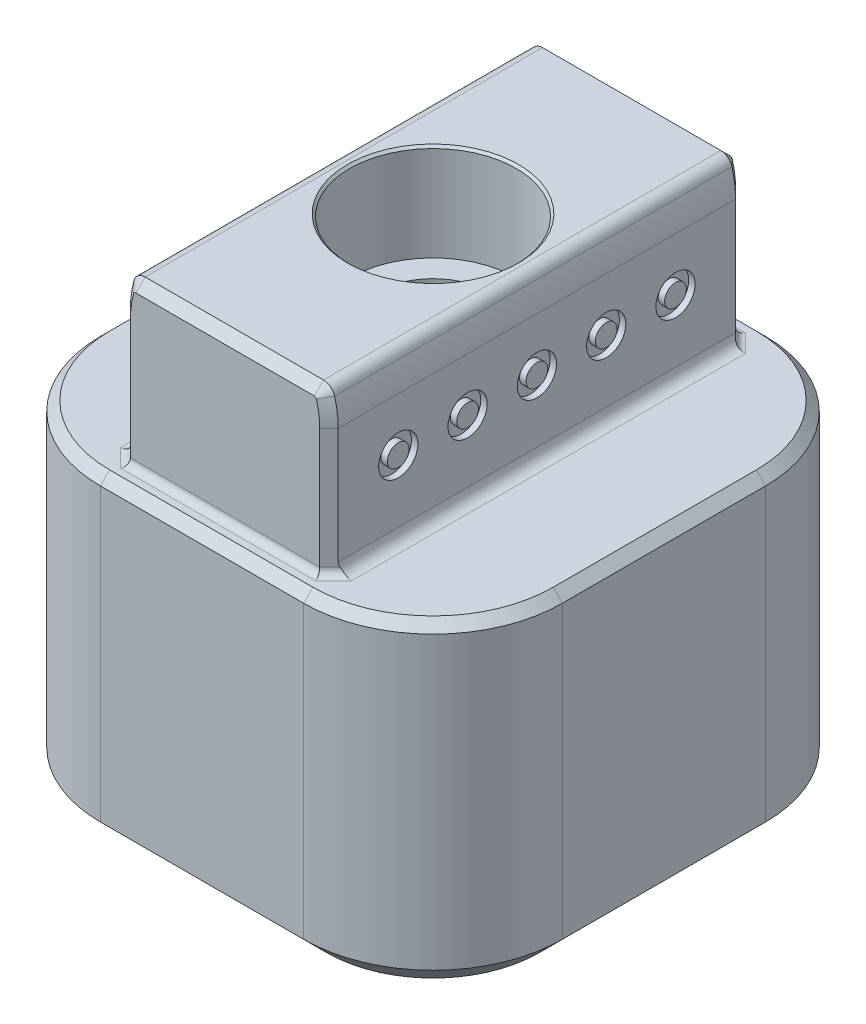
SolidWorks part; units mm, degrees
ref_plane "Front Plane" through (0, 0, 0) normal (0, 0, 1) x (1, 0, 0)
ref_plane "Top Plane" through (0, 0, 0) normal (0, 1, 0) x (1, 0, 0)
ref_plane "Right Plane" through (0, 0, 0) normal (1, 0, 0) x (0, 0, -1)
sketch "Sketch1" plane through (0, 0, 0) normal (0, 1, 0) x (1, 0, 0)
  line L0 (-10, 0) -> (10, 0) construction
  line L1 (-4.4, 10) -> (4.4, 10)
  line L2 (-10, 4.4) -> (-10, -4.4)
  line L3 (-4.4, -10) -> (4.4, -10)
  line L4 (10, 4.4) -> (10, -4.4)
  line L5 (0, 10) -> (0, -10) construction
  arc A4 (4.4, 10) -> (10, 4.4) centre (4.4, 4.4) cw
  arc A5 (10, -4.4) -> (4.4, -10) centre (4.4, -4.4) cw
  arc A6 (-4.4, -10) -> (-10, -4.4) centre (-4.4, -4.4) cw
  arc A7 (-10, 4.4) -> (-4.4, 10) centre (-4.4, 4.4) cw
  dimension "D3" = 5.6
  dimension "D1" = 20
  dimension "D2" = 20
extrude "Boss-Extrude1" add sketch "Sketch1" along normal blind 14 from offset 14
sketch "Sketch2" plane through (0, 0, 0) normal (0, 1, 0) x (1, 0, 0)
  line L0 (0, 9) -> (0, -9) construction
  line L1 (-4.4975, 9) -> (4.4975, 9)
  line L2 (-4.4975, 9) -> (-4.4975, -9)
  line L3 (-4.4975, -9) -> (4.4975, -9)
  line L4 (4.4975, 9) -> (4.4975, -9)
  line L5 (-4.4975, 0) -> (4.4975, 0) construction
  line L6 (4.4, 10) -> (-4.4, 10) construction
  dimension "D1" = 8.995
  dimension "D2" = 1
extrude "Boss-Extrude2" add sketch "Sketch2" along normal blind 7
sketch "Sketch3" plane through (0, 0, 9) normal (0, 0, 1) x (1, 0, 0)
  line L0 (4.4975, 7) -> (4.4975, 0) construction
  line L1 (-4.4975, 7) -> (4.4975, 7) construction
  line L2 (3.8598, 7) -> (4.4975, 7)
  line L3 (4.4975, 7) -> (4.4975, 5.5)
  line L4 (0, 0) -> (0, 7) construction
  line L5 (-4.4975, 7) -> (-4.4975, 5.5)
  line L6 (-3.8598, 7) -> (-4.4975, 7)
  arc A0 (4.4975, 5.5) -> (4.3412, 6.6351) centre (0.2975, 5.5) ccw
  arc A1 (4.3412, 6.6351) -> (3.8598, 7) centre (3.8598, 6.5) ccw
  arc A2 (-4.3412, 6.6351) -> (-3.8598, 7) centre (-3.8598, 6.5) cw
  arc A3 (-4.4975, 5.5) -> (-4.3412, 6.6351) centre (-0.2975, 5.5) cw
  dimension "D2" = 4.2
  dimension "D3" = 0.5
  dimension "D1" = 1.5
extrude "Cut-Extrude3" cut sketch "Sketch3" against normal through all
hole_wizard "CBORE for M4 SHCS1" positions "Sketch4" profile "Sketch5" counterbore size "M4" standard "ANSI Metric"
sketch "Sketch4" plane through (0, 7, 0) normal (0, 1, 0) x (1, 0, 0)
  point P0 (0, 0)
sketch "Sketch5" plane through (0, 7, 0) normal (1, 0, 0) x (0, 0, 1)
  line L0 (0, 0) -> (0, 21)
  line L1 (0, 21) -> (2.5, 21)
  line L3 (2.5, 21) -> (2.5, 4.2)
  line L4 (2.5, 4.2) -> (3.6, 4.2)
  line L5 (3.6, 4.2) -> (3.6, 0)
  line L7 (3.6, 0) -> (0, 0)
  line L11 (0, -6.35) -> (0, 107.95) construction
  dimension "Thru Hole Dia." = 5
  dimension "Thru Hole Depth" = 21
  dimension "C'Bore Dia." = 7.2
  dimension "C'Bore Depth" = 4.2
hole_wizard "M6x1.0 Tapped Hole1" positions "Sketch6" profile "Sketch7" tap size "M6x1.0" standard "ANSI Metric"
sketch "Sketch6" plane through (0, 2.8, 0) normal (0, 1, 0) x (1, 0, 0)
  point P0 (0, 0)
sketch "Sketch7" plane through (0, 2.8, 0) normal (1, 0, 0) x (0, 0, 1)
  line L0 (0, 0) -> (0, 16.8)
  line L1 (0, 16.8) -> (2.5005, 16.8)
  line L2 (2.5005, 16.8) -> (2.5005, 0)
  line L5 (2.5005, 0) -> (0, 0)
  line L11 (0, -6.35) -> (0, 107.95) construction
  dimension "Thru Tap Drill Dia." = 5.001
  dimension "Thru Tap Drill Depth" = 16.8
sketch "Sketch8" plane through (4.4975, 0, 0) normal (1, 0, 0) x (0, 0, -1)
  line L0 (-9, 5.5) -> (-9, 0) construction
  line L1 (-9, 7) -> (9, 7) construction
  circle A0 centre (-6, 3.2) radius 0.85
  circle A1 centre (-6, 3.2) radius 0.47
  circle A2 centre (-3, 3.2) radius 0.85
  circle A3 centre (-3, 3.2) radius 0.47
  circle A4 centre (0, 3.2) radius 0.85
  circle A5 centre (0, 3.2) radius 0.47
  circle A6 centre (3, 3.2) radius 0.85
  circle A7 centre (3, 3.2) radius 0.47
  circle A8 centre (6, 3.2) radius 0.85
  circle A9 centre (6, 3.2) radius 0.47
  dimension "D3" = 1.7
  dimension "D4" = 0.38
  dimension "D6" = 3
  dimension "D1" = 3
  dimension "D2" = 3.8
  dimension "D5" = 5
extrude "Cut-Extrude4" cut sketch "Sketch8" against normal blind 0.28
mirror "Mirror1" about plane through (0, 0, 0) normal (1, 0, 0) of "Cut-Extrude4"
chamfer "Chamfer1" distance 0.4 angle 45 22 edges at (4.4975, 2.75, -9) (4.4582, 6.0729, -9) (4.1618, 6.8985, -9) (0, 7, -9) (-4.1618, 6.8985, -9) (-4.4582, 6.0729, -9) (-4.4975, 2.75, -9) (4.4975, 2.75, 9) (4.4582, 6.0729, 9) (4.1618, 6.8985, 9) (0, 7, 9) (-4.1618, 6.8985, 9) (-4.4582, 6.0729, 9) (-4.4975, 2.75, 9) (0, 0, 10) (-10, 0, 0) (0, 0, -10) (10, 0, 0) (-8.3598, 0, 8.3598) (-8.3598, 0, -8.3598) (8.3598, 0, 8.3598) (8.3598, 0, -8.3598)
fillet "Fillet1" radius 0.5 2 edges at (-4.4975, 0, 0) (4.4975, 0, 0)
fillet "Fillet2" radius 0.3 6 edges at (0, 0, -9) (0, 0, 9) (-4.5475, 0, -8.55) (4.5475, 0, -8.55) (4.5475, 0, 8.55) (-4.5475, 0, 8.55)
chamfer "Chamfer2" distance 1 angle 45 8 edges at (-8.3598, -14, -8.3598) (0, -14, -10) (8.3598, -14, -8.3598) (10, -14, 0) (8.3598, -14, 8.3598) (0, -14, 10) (-8.3598, -14, 8.3598) (-10, -14, 0)
chamfer "Chamfer3" distance 0.5 angle 45 1 edges at (0, -14, 2.5005)
chamfer "Chamfer4" distance 0.1 angle 45 1 edges at (0, 7, 3.6)
sketch "Sketch9" plane through (0, -14, 0) normal (0, -1, 0) x (1, 0, 0)
  line L0 (-5, -10) -> (5, -10)
  line L1 (10, -5) -> (10, 5)
  line L2 (5, 10) -> (-5, 10)
  line L3 (-10, 5) -> (-10, -5)
  line L4 (-10, 4.4) -> (-10, -4.4) construction
  line L5 (-4.4, -10) -> (4.4, -10) construction
  line L6 (10, -4.4) -> (10, 4.4) construction
  line L7 (4.4, 10) -> (-4.4, 10) construction
  arc A0 (-10, -5) -> (-5, -10) centre (-5, -5) ccw
  arc A1 (10, 5) -> (5, 10) centre (5, 5) ccw
  arc A2 (-5, 10) -> (-10, 5) centre (-5, 5) ccw
  arc A3 (10, -5) -> (5, -10) centre (5, -5) cw
  dimension "D1" = 5
  dimension "D2" = 5
  dimension "D3" = 5
